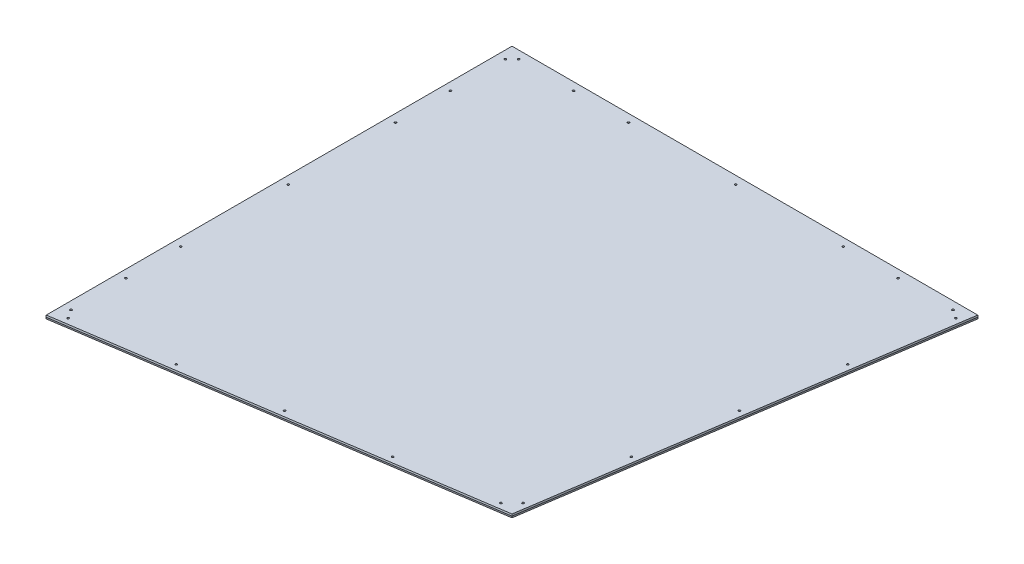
SolidWorks part; units mm, degrees
ref_plane "Front Plane" through (0, 0, 0) normal (0, 0, 1) x (1, 0, 0)
ref_plane "Top Plane" through (0, 0, 0) normal (0, 1, 0) x (1, 0, 0)
ref_plane "Right Plane" through (0, 0, 0) normal (1, 0, 0) x (0, 0, -1)
sketch "Sketch2" plane through (0, 0, 0) normal (0, 1, 0) x (1, 0, 0)
  line L0 (0, 0) -> (0, -1212.85) construction
  line L1 (0, -1212.85) -> (1055.0672, -1055.0672) construction
  line L2 (1212.85, 0) -> (1055.0672, -1055.0672) construction
  line L3 (0, 0) -> (1212.85, 0) construction
  line L4 (0, 0) -> (0, -1212.85)
  line L5 (0, -1212.85) -> (1055.0672, -1055.0672)
  line L6 (1212.85, 0) -> (1055.0672, -1055.0672)
  line L7 (0, 0) -> (1212.85, 0)
extrude "Boss-Extrude1" add sketch "Sketch2" along normal mid plane 8.7312
sketch "Sketch3" plane through (0, 0, 0) normal (-1, 0, 0) x (0, 0, 1)
  line L0 (1212.85, 0) -> (1212.1971, 4.3656)
  line L1 (1212.85, 4.3656) -> (1212.85, -4.3656) construction
  line L2 (1212.85, 0) -> (1212.1971, -4.3656)
  line L3 (1212.1971, -4.3656) -> (1215.39, -4.3656)
  line L4 (1215.39, -4.3656) -> (1215.39, 4.3656)
  line L5 (1215.39, 4.3656) -> (1212.1971, 4.3656)
  line L6 (0, 4.3656) -> (1212.85, 4.3656) construction
  line L7 (0, -4.3656) -> (1212.85, -4.3656) construction
  line L8 (1212.1971, 4.3656) -> (1055.0672, 1055.0672) construction
  dimension "D1" = 2.54
  dimension "D2" = 8.505
extrude "Cut-Extrude1" cut sketch "Sketch3" along direction (0.989, 0, -0.1479) on the side against the normal through all
sketch "Sketch4" plane through (0, 0, 0) normal (0, 0, -1) x (-1, 0, 0)
  line L0 (-1212.85, 0) -> (-1212.1971, 4.3656)
  line L1 (-1212.85, 4.3656) -> (-1212.85, -4.3656) construction
  line L2 (-1212.85, 0) -> (-1212.1971, -4.3656)
  line L3 (-1212.1971, -4.3656) -> (-1215.39, -4.3656)
  line L4 (-1215.39, -4.3656) -> (-1215.39, 4.3656)
  line L5 (-1215.39, 4.3656) -> (-1212.1971, 4.3656)
  line L6 (-1212.85, 4.3656) -> (0, 4.3656) construction
  line L7 (-1212.85, -4.3656) -> (0, -4.3656) construction
  line L11 (-1212.1971, 4.3656) -> (-1055.0672, 1055.0672) construction
  dimension "D1" = 2.54
  dimension "D2" = 8.505
extrude "Cut-Extrude2" cut sketch "Sketch4" along direction (0.1479, 0, -0.989) on the side against the normal through all
sketch "Sketch5" plane through (0, -4.3656, 0) normal (0, -1, 0) x (1, 0, 0)
  line L0 (0, 20.6248) -> (38.1, 20.6248) construction
  line L1 (0, 0) -> (0, 1212.1971) construction
  line L2 (20.6248, 0) -> (20.6248, 38.1) construction
  line L3 (1212.1971, 0) -> (0, 0) construction
  line L4 (38.1, 20.6248) -> (180.975, 20.6248) construction
  line L5 (180.975, 20.6248) -> (323.85, 20.6248) construction
  line L6 (323.85, 20.6248) -> (603.25, 20.6248) construction
  line L7 (603.25, 20.6248) -> (882.65, 20.6248) construction
  line L8 (882.65, 20.6248) -> (1025.525, 20.6248) construction
  line L9 (1025.525, 20.6248) -> (1168.4, 20.6248) construction
  line L10 (1168.4, 20.6248) -> (1209.1127, 20.6248) construction
  line L11 (1054.4993, 1054.4993) -> (1212.1971, 0) construction
  line L12 (20.6248, 38.1) -> (20.6248, 180.975) construction
  line L13 (20.6248, 180.975) -> (20.6248, 323.85) construction
  line L14 (20.6248, 323.85) -> (20.6248, 603.25) construction
  line L15 (20.6248, 603.25) -> (20.6248, 882.65) construction
  line L16 (20.6248, 882.65) -> (20.6248, 1025.525) construction
  line L17 (20.6248, 1025.525) -> (20.6248, 1168.4) construction
  line L18 (20.6248, 1168.4) -> (20.6248, 1209.1127) construction
  line L19 (0, 1212.1971) -> (1054.4993, 1054.4993) construction
  line L20 (0, 1196.0939) -> (35.6765, 1190.7586) construction
  line L21 (35.6765, 1190.7586) -> (280.6029, 1154.1304) construction
  line L22 (280.6029, 1154.1304) -> (525.5292, 1117.5023) construction
  line L23 (525.5292, 1117.5023) -> (770.4555, 1080.8741) construction
  line L24 (770.4555, 1080.8741) -> (1015.3818, 1044.246) construction
  line L25 (1015.3818, 1044.246) -> (1056.9626, 1038.0277) construction
  line L26 (1196.0939, 0) -> (1190.7586, 35.6765) construction
  line L27 (1190.7586, 35.6765) -> (1154.1304, 280.6029) construction
  line L28 (1154.1304, 280.6029) -> (1117.5023, 525.5292) construction
  line L29 (1117.5023, 525.5292) -> (1080.8741, 770.4555) construction
  line L30 (1080.8741, 770.4555) -> (1044.246, 1015.3818) construction
  line L31 (1044.246, 1015.3818) -> (1038.0277, 1056.9626) construction
  line L32 (678.6742, 0) -> (-678.6742, 0) construction
  circle A0 centre (35.6765, 1190.7586) radius 2.5794
  circle A1 centre (20.6248, 1168.4) radius 2.5794
  circle A2 centre (20.6248, 1025.525) radius 2.5794
  circle A3 centre (280.6029, 1154.1304) radius 2.5794
  circle A4 centre (525.5292, 1117.5023) radius 2.5794
  circle A5 centre (770.4555, 1080.8741) radius 2.5794
  circle A6 centre (1015.3818, 1044.246) radius 2.5794
  circle A7 centre (1044.246, 1015.3818) radius 2.5794
  circle A8 centre (1080.8741, 770.4555) radius 2.5794
  circle A9 centre (1117.5023, 525.5292) radius 2.5794
  circle A10 centre (1154.1304, 280.6029) radius 2.5794
  circle A11 centre (1168.4, 20.6248) radius 2.5794
  circle A12 centre (1190.7586, 35.6765) radius 2.5794
  circle A13 centre (1025.525, 20.6248) radius 2.5794
  circle A14 centre (882.65, 20.6248) radius 2.5794
  circle A15 centre (603.25, 20.6248) radius 2.5794
  circle A16 centre (323.85, 20.6248) radius 2.5794
  circle A17 centre (180.975, 20.6248) radius 2.5794
  circle A18 centre (38.1, 20.6248) radius 2.5794
  circle A19 centre (20.6248, 38.1) radius 2.5794
  circle A20 centre (20.6248, 180.975) radius 2.5794
  circle A21 centre (20.6248, 323.85) radius 2.5794
  circle A22 centre (20.6248, 603.25) radius 2.5794
  circle A23 centre (20.6248, 882.65) radius 2.5794
  circle A24 centre (35.6765, 1190.7586) radius 2.5527 construction
  circle A25 centre (1190.7586, 35.6765) radius 2.5527 construction
  dimension "D27" = 5.1587
  dimension "D1" = 38.1
  dimension "D2" = 20.6248
  dimension "D3" = 20.6248
  dimension "D4" = 38.1
  dimension "D5" = 142.875
  dimension "D6" = 142.875
  dimension "D7" = 279.4
  dimension "D8" = 279.4
  dimension "D9" = 142.875
  dimension "D10" = 142.875
  dimension "D11" = 40.7127
  dimension "D12" = 142.875
  dimension "D13" = 142.875
  dimension "D14" = 279.4
  dimension "D15" = 279.4
  dimension "D16" = 142.875
  dimension "D17" = 142.875
  dimension "D18" = 40.7127
  dimension "D21" = 247.65
  dimension "D22" = 42.0431
  dimension "D25" = 247.65
  dimension "D26" = 42.0431
extrude "Cut-Extrude3" cut sketch "Sketch5" against normal through all
sketch "Sketch6" [suppressed] plane through (0, -4.3656, 0) normal (0, -1, 0) x (1, 0, 0)
  line L0 (203.2, 782.031) -> (203.2, 0)
  line L1 (203.2, 0) -> (1007.3903, 0)
  line L2 (1007.3903, 0) -> (899.2393, 723.1879)
  line L3 (813.7836, 808.6436) -> (319.8269, 882.5136)
  line L4 (1212.1971, 0) -> (0, 0) construction
  line L6 (0, 1212.1971) -> (1054.4993, 1054.4993) construction
  line L7 (1054.4993, 1054.4993) -> (1212.1971, 0) construction
  line L8 (1055.0672, 1055.0672) -> (0, 1212.85) construction
  line L9 (1055.0672, 1055.0672) -> (1212.85, 0) construction
  line L10 (0, 0) -> (0, 1212.1971) construction
  arc A0 (899.2393, 723.1879) -> (813.7836, 808.6436) centre (798.7567, 708.161) ccw
  arc A1 (203.2, 782.031) -> (319.8269, 882.5136) centre (304.8, 782.031) cw
  dimension "D4" = 101.6
  dimension "D1" = 279.4
  dimension "D2" = 203.2
  dimension "D3" = 203.2
extrude "Cut-Extrude4" [suppressed] cut sketch "Sketch6" against normal through all
